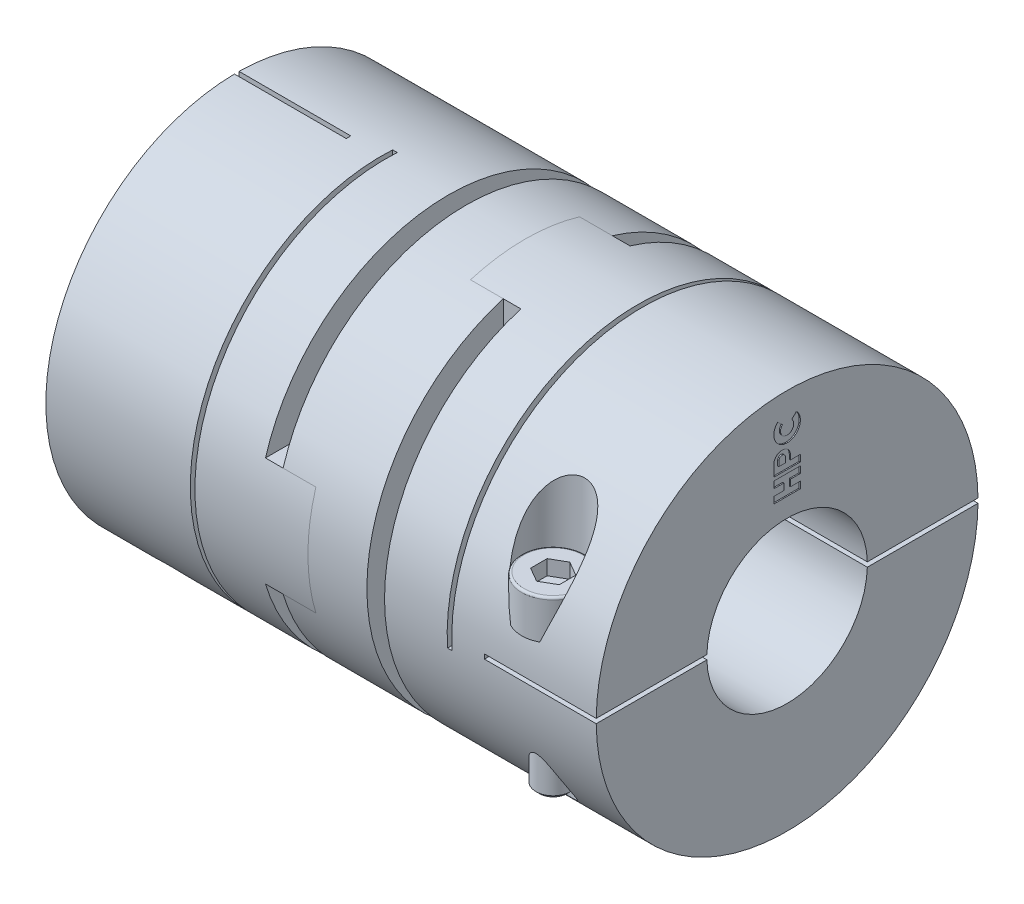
SolidWorks part; units mm, degrees
ref_plane "Front" through (0, 0, 0) normal (0, 0, 1) x (1, 0, 0)
ref_plane "Top" through (0, 0, 0) normal (0, 1, 0) x (1, 0, 0)
ref_plane "Right" through (0, 0, 0) normal (1, 0, 0) x (0, 0, -1)
imported_body "_HPC - BGC3312-1_1-1-solid1"
imported_body "_HPC - BGC33_2_1-1-solid1"
imported_body "_HPC - BGC3314-3-1-solid1"
sketch "Esquisse1" plane through (0, 0, 0) normal (0, 0, 1) x (1, 0, 0)
  line L0 (0, 0) -> (54.6813, 0) construction
  line L1 (0, 5.9967) -> (13, 5.9967)
  line L2 (0, 5.9967) -> (0, 0)
  line L3 (0, 0) -> (13, 0)
  line L4 (13, 5.9967) -> (13, 0)
  line L5 (47.9999, 7) -> (34.9999, 7) construction
  line L6 (47.9999, 7) -> (47.9999, 0) construction
  line L7 (47.9999, 0) -> (34.9999, 0) construction
  line L8 (34.9999, 7) -> (34.9999, 0) construction
  line L9 (50, 0) -> (-50, 0) construction
  dimension "D1" = 13
revolve "Enlèvement de matière-Révolution1" cut sketch "Esquisse1" angle 360 about L0
sketch "Esquisse2" plane through (39.3999, 0, 0) normal (1, 0, 0) x (0, 0, -1)
  circle A0 centre (0, 0) radius 7
extrude "Enlèv. mat.-Extru.1" cut sketch "Esquisse2" against normal blind 4
